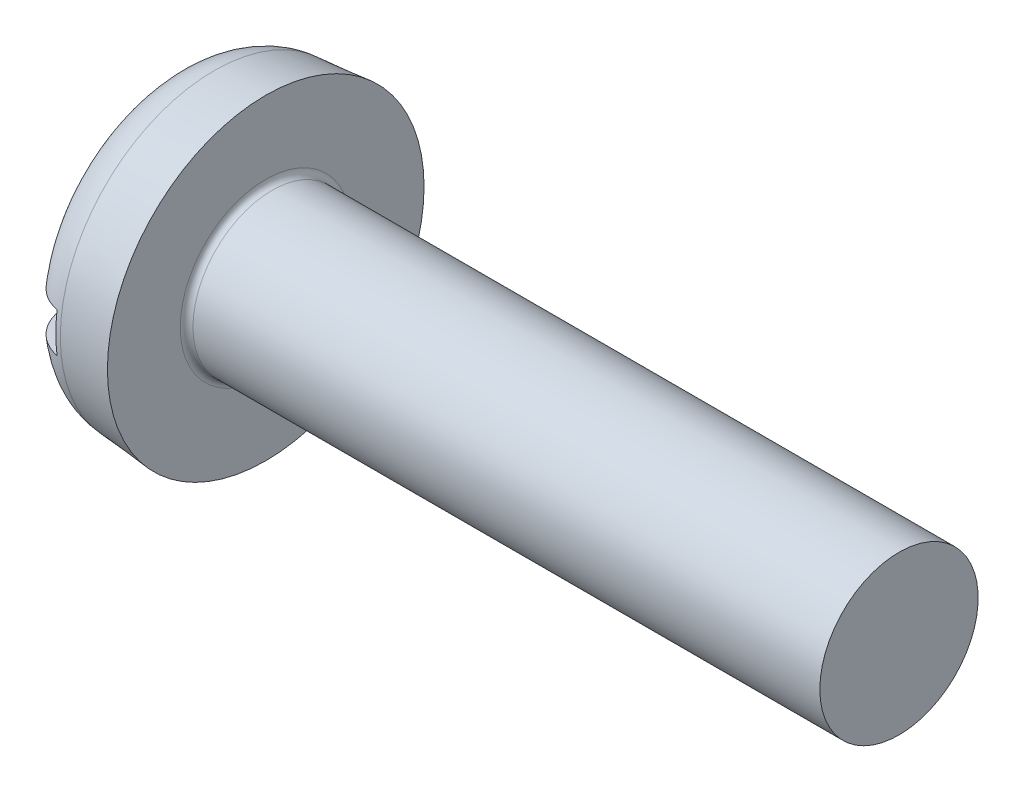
SolidWorks part; units mm, degrees
ref_plane "Front Plane" through (0, 0, 0) normal (0, 0, 1) x (1, 0, 0)
ref_plane "Top Plane" through (0, 0, 0) normal (0, 1, 0) x (1, 0, 0)
ref_plane "Right Plane" through (0, 0, 0) normal (1, 0, 0) x (0, 0, -1)
other "Configuration Table"
sketch "BodySke" plane through (0, 0, 0) normal (0, 0, 1) x (1, 0, 0)
  line L0 (0, 0) -> (111.3824, 0) construction
  line L1 (0, 0) -> (0, 9.4751)
  line L2 (0, 9.4751) -> (6, 10)
  line L3 (6, 10) -> (6, 5)
  line L4 (6, 5) -> (46, 5)
  line L5 (46, 5) -> (46, 0)
  line L6 (7.5, 8.824) -> (7.5, -5.8939) construction
  line L7 (0, 0) -> (46, 0)
  line L8 (8, 8.824) -> (8, -4.958) construction
  point P10 (46, 4.172)
revolve "BaseBody" add sketch "BodySke" angle 360 about L0
fillet "Fillet_head" radius 3 1 edges at (0, 0, 9.4751)
fillet "Fillet2" radius 0.4 1 edges at (6, 0, 5)
sketch "SlotSke" plane through (0, 0, 0) normal (-1, 0, 0) x (0, 0, 1)
  line L1 (-10, 1.25) -> (10, 1.25)
  line L2 (-10, 1.25) -> (-10, -1.25)
  line L3 (-10, -1.25) -> (10, -1.25)
  line L4 (10, 1.25) -> (10, -1.25)
extrude "Slot" cut sketch "SlotSke" against normal blind 2.4
sketch "ThdSchSke" plane through (0, 0, 0) normal (0, 0, 1) x (1, 0, 0)
  line L0 (0, 0) -> (55.1256, 0) construction
  line L1 (0, 0) -> (111.3824, 0) construction
  line L2 (45.522, 5) -> (45.522, 5.9561)
  line L3 (45.522, 5.9561) -> (46.478, 5.9561)
  line L4 (46.478, 5.9561) -> (46.478, 5)
  line L5 (46.478, 5) -> (46, 4.172)
  line L6 (46, 4.172) -> (45.522, 5)
  line L7 (6, 5) -> (46, 5) construction
  line L13 (46, 5) -> (46, 0) construction
revolve "ThreadSchematic" [suppressed] cut sketch "ThdSchSke" angle 360 about L0
pattern_linear "ThdSchPat" [suppressed] count 25 along (1, 0, 0)
equation "\"Thread_minor@ThreadCosmetic\" = \"Thread_minor@BodySke\""
equation "\"D1@SlotSke\" = \"Head_dia@BodySke\""
equation "\"D2@SlotSke\" = \"D1@SlotSke\" / 2"
equation "\"D3@SlotSke\" = \"Slot_width@SlotSke\" / 2"
equation "\"Advance@ThdSchPat\" = \"Advance@BodySke\""
equation "\"D1@ThdSchPat\" =  int( \"Thread_length@BodySke\" /\"Advance@ThdSchPat\" ) "
